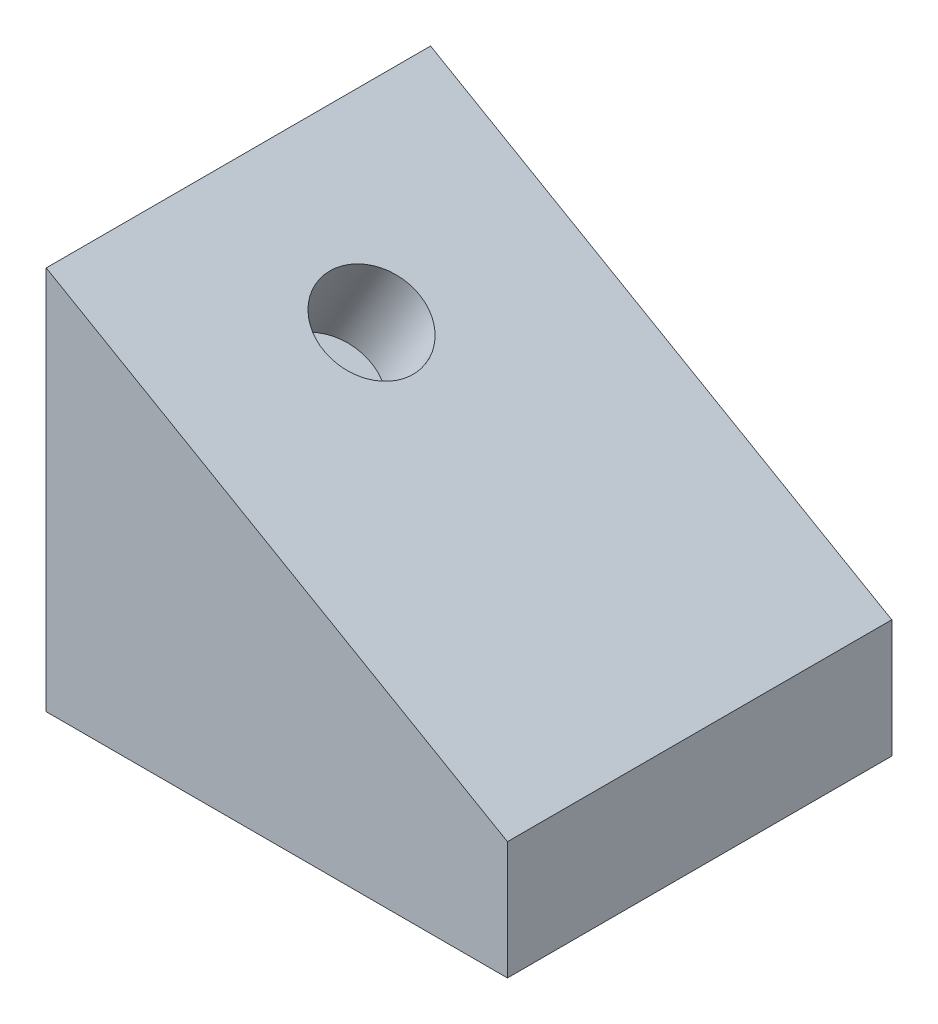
SolidWorks part; units mm, degrees
ref_plane "Front Plane" through (0, 0, 0) normal (0, 0, 1) x (1, 0, 0)
ref_plane "Top Plane" through (0, 0, 0) normal (0, 1, 0) x (1, 0, 0)
ref_plane "Right Plane" through (0, 0, 0) normal (1, 0, 0) x (0, 0, -1)
sketch "Sketch1" plane through (0, 0, 0) normal (0, 0, 1) x (1, 0, 0)
  line L0 (0, 0) -> (0, 20)
  line L1 (0, 20) -> (24, 6.1436)
  line L2 (24, 6.1436) -> (24, 0)
  line L3 (24, 0) -> (0, 0)
  dimension "D1" = 60
  dimension "D2" = 24
  dimension "D3" = 20
extrude "Boss-Extrude1" add sketch "Sketch1" along normal mid plane 20
sketch "Sketch2" plane through (0, 0, 0) normal (0, -1, 0) x (1, 0, 0)
  line L0 (0, 0) -> (24, 0) construction
  line L1 (24, 10) -> (24, -10) construction
  circle A0 centre (14, 0) radius 2.5
  dimension "D1" = 5
  dimension "D2" = 10
extrude "Cut-Extrude1" cut sketch "Sketch2" against normal blind 5
sketch "Sketch3" plane through (8.6603, 15, 0) normal (0.5, 0.866, 0) x (0.866, -0.5, 0)
  line L0 (-10, 0) -> (17.7128, 0) construction
  line L1 (-10, -10) -> (-10, 10) construction
  line L2 (17.7128, -10) -> (17.7128, 10) construction
  circle A0 centre (-2, 0) radius 2.5
  dimension "D1" = 5
  dimension "D2" = 8
extrude "Cut-Extrude2" cut sketch "Sketch3" against normal blind 5
